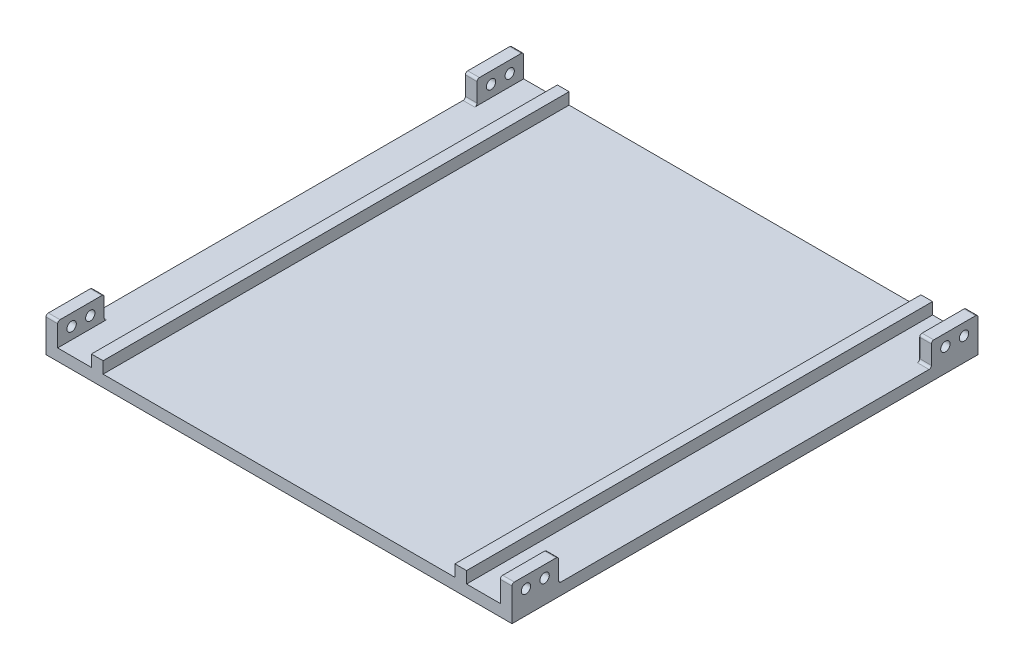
SolidWorks part; units mm, degrees
ref_plane "Front Plane" through (0, 0, 0) normal (0, 0, 1) x (1, 0, 0)
ref_plane "Top Plane" through (0, 0, 0) normal (0, 1, 0) x (1, 0, 0)
ref_plane "Right Plane" through (0, 0, 0) normal (1, 0, 0) x (0, 0, -1)
sketch "Sketch1" plane through (0, 0, 0) normal (0, 0, 1) x (1, 0, 0)
  line L0 (0, 61.0283) -> (0, -74.0792) construction
  line L1 (-100, -5) -> (100, -5)
  line L2 (-100, -5) -> (-100, 0)
  line L3 (-100, 0) -> (100, 0)
  line L4 (100, -5) -> (100, 0)
  dimension "D1" = 200
  dimension "D2" = 5
extrude "Boss-Extrude1" add sketch "Sketch1" along normal mid plane 200
sketch "Sketch2" plane through (0, 0, 0) normal (0, 1, 0) x (1, 0, 0)
  line L0 (100, 100) -> (-100, 100) construction
  line L1 (-80.5, 100) -> (-75.5, 100)
  line L2 (-80.5, 100) -> (-80.5, -100)
  line L3 (-80.5, -100) -> (-75.5, -100)
  line L4 (-75.5, 100) -> (-75.5, -100)
  line L5 (100, -100) -> (-100, -100) construction
  line L6 (0, 100) -> (0, -100) construction
  line L7 (75.5, 100) -> (75.5, -100)
  line L8 (80.5, -100) -> (75.5, -100)
  line L9 (80.5, 100) -> (80.5, -100)
  line L10 (80.5, 100) -> (75.5, 100)
  dimension "D1" = 151
  dimension "D2" = 5
extrude "Boss-Extrude2" add sketch "Sketch2" along normal blind 5
sketch "Sketch3" plane through (0, 0, 0) normal (0, 1, 0) x (1, 0, 0)
  line L1 (-100, -100) -> (-95, -100)
  line L2 (-100, -100) -> (-100, -80)
  line L3 (-100, -80) -> (-95, -80)
  line L4 (-95, -100) -> (-95, -80)
  line L9 (-75.5, 0) -> (75.5, 0) construction
  line L10 (-75.5, -100) -> (-75.5, 100) construction
  line L11 (75.5, 100) -> (75.5, -100) construction
  line L12 (-95, 100) -> (-95, 80)
  line L13 (-100, 80) -> (-95, 80)
  line L14 (-100, 100) -> (-100, 80)
  line L15 (-100, 100) -> (-95, 100)
  dimension "D1" = 5
  dimension "D2" = 20
extrude "Boss-Extrude3" add sketch "Sketch3" along normal blind 10
sketch "Sketch4" plane through (-100, 0, 0) normal (-1, 0, 0) x (0, 0, 1)
  line L0 (-100, 5) -> (100, 5) construction
  line L1 (-90, 10) -> (-90, 0) construction
  line L2 (-100, 10) -> (-80, 10) construction
  line L3 (-80, 0) -> (-100, 0) construction
  line L4 (0, 0) -> (0, 30.515) construction
  line L5 (80, 0) -> (-80, 0) construction
  line L6 (90, 10) -> (90, 0) construction
  line L7 (0, 0) -> (0, 30.515) construction
  line L8 (80, 0) -> (-80, 0) construction
  line L9 (-90, 10) -> (-90, 0) construction
  circle A0 centre (-94, 5) radius 2
  circle A1 centre (-86, 5) radius 2
  circle A2 centre (-94, 5) radius 2
  circle A3 centre (-86, 5) radius 2
  circle A4 centre (86, 5) radius 2
  circle A5 centre (94, 5) radius 2
  circle A6 centre (86, 5) radius 2
  circle A7 centre (94, 5) radius 2
  circle A8 centre (-94, 5) radius 2
  circle A9 centre (-86, 5) radius 2
  circle A10 centre (-94, 5) radius 2
  circle A11 centre (-86, 5) radius 2
  dimension "D1" = 4
  dimension "D2" = 8
  dimension "D3" = 172
extrude "Cut-Extrude1" cut sketch "Sketch4" against normal blind 10 contours A9 | A8 | A5 | A4 | A1 | A0
fillet "Fillet1" radius 1 6 edges at (-97.5, 10, -100) (-97.5, 10, -80) (-97.5, 0, -80) (-97.5, 0, 80) (-97.5, 10, 80) (-97.5, 10, 100)
mirror "Mirror1" about plane through (0, 0, 0) normal (1, 0, 0) of "Boss-Extrude3", "Fillet1", "Cut-Extrude1"
